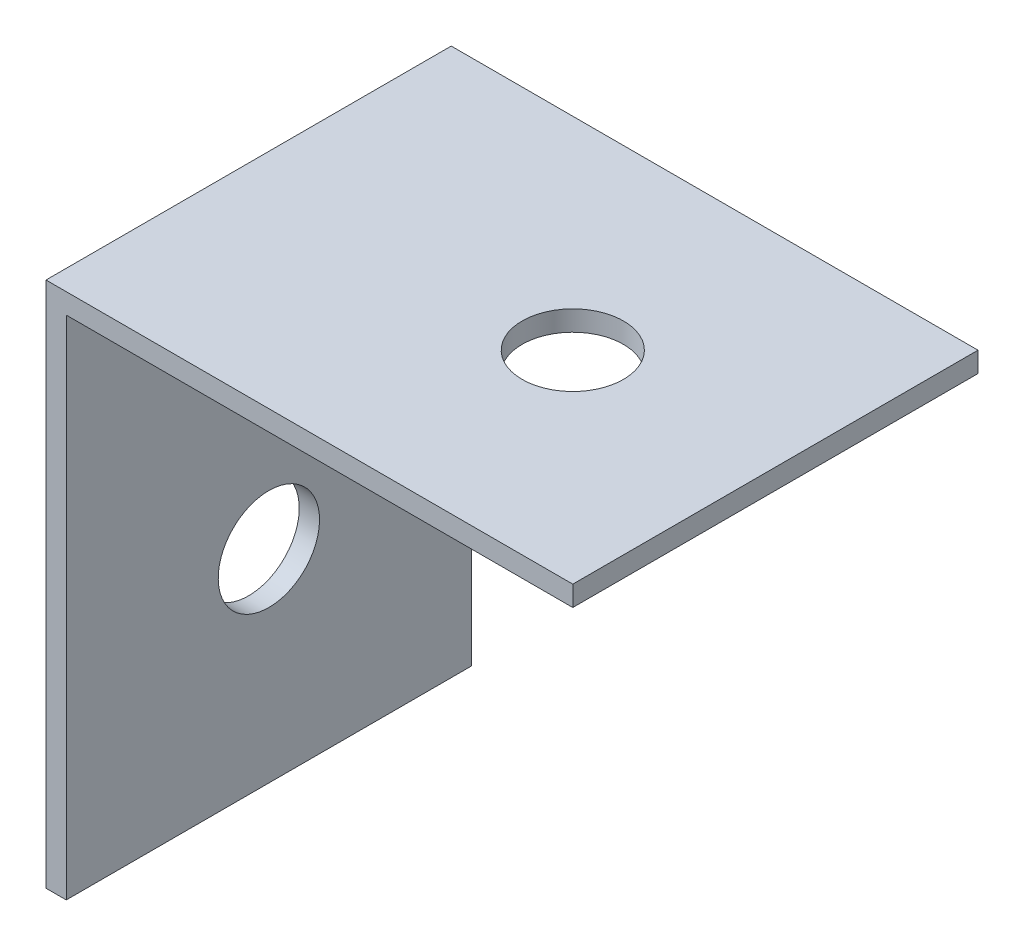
SolidWorks part; units mm, degrees
ref_plane "Front Plane" through (0, 0, 0) normal (0, 0, 1) x (1, 0, 0)
ref_plane "Top Plane" through (0, 0, 0) normal (0, 1, 0) x (1, 0, 0)
ref_plane "Right Plane" through (0, 0, 0) normal (1, 0, 0) x (0, 0, -1)
sketch "Sketch1" plane through (0, 0, 0) normal (0, 0, 1) x (1, 0, 0)
  line L0 (0, 0) -> (25, 0)
  line L1 (0, 0) -> (0, -25)
  dimension "D1" = 25
  dimension "D2" = 25
extrude "Extrude-Thin1" add sketch "Sketch1" along normal blind 10 and the other way blind 10 thin
sketch "Sketch2" plane through (0, 1, 0) normal (0, 1, 0) x (-1, 0, 0)
  line L0 (-25, 0) -> (0, 0) construction
  line L1 (-25, 10) -> (-25, -10) construction
  circle A0 centre (-15, 0) radius 2.5
  dimension "D1" = 5
  dimension "D2" = 10
extrude "Cut hål 1" cut sketch "Sketch2" against normal up to next
sketch "Sketch3" plane through (0, 0, 0) normal (1, 0, 0) x (0, 0, -1)
  line L0 (0, -25) -> (0, 0) construction
  line L1 (-10, -25) -> (10, -25) construction
  circle A0 centre (0, -15) radius 2.5
  dimension "D1" = 5
  dimension "D2" = 10
extrude "Cut hål 2" cut sketch "Sketch3" against normal up to next
